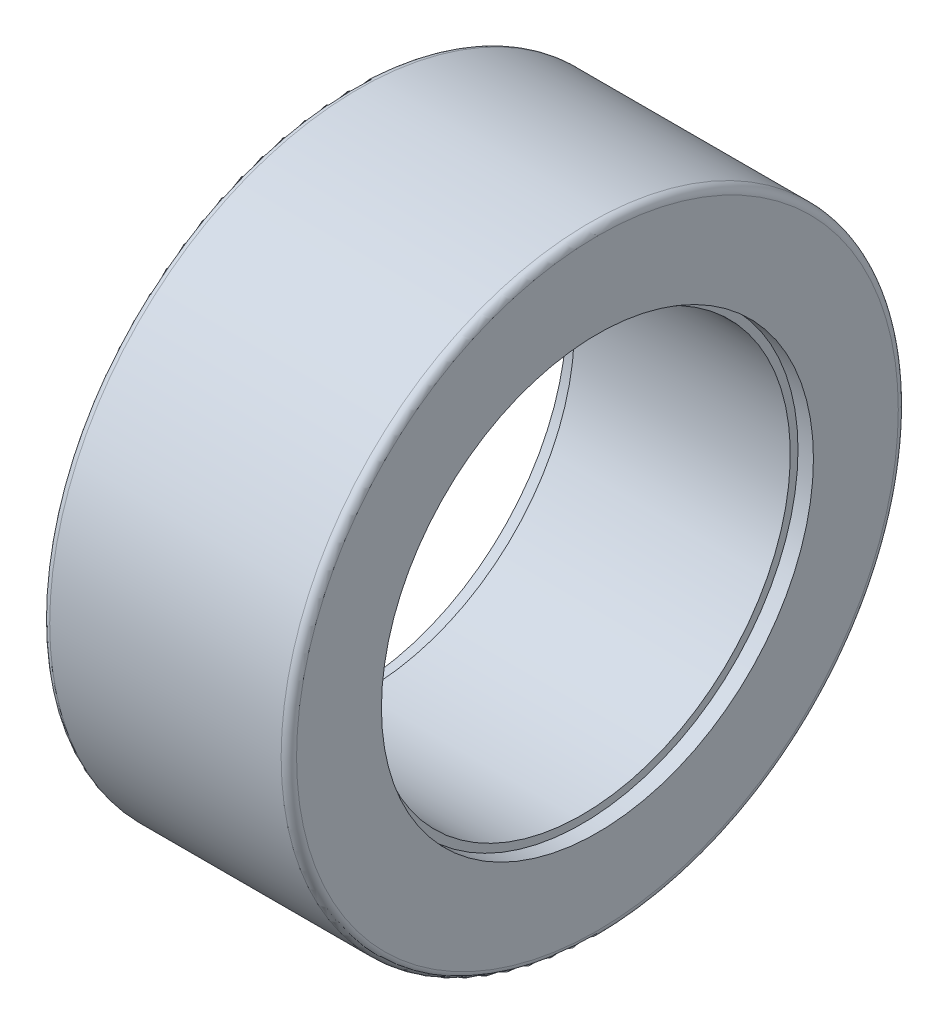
SolidWorks part; units mm, degrees
ref_plane "Front Plane" through (0, 0, 0) normal (0, 0, 1) x (1, 0, 0)
ref_plane "Top Plane" through (0, 0, 0) normal (0, 1, 0) x (1, 0, 0)
ref_plane "Right Plane" through (0, 0, 0) normal (1, 0, 0) x (0, 0, -1)
sketch "Sketch1" plane through (0, 0, 0) normal (0, 0, 1) x (1, 0, 0)
  line L0 (-79.5574, 0) -> (64.7749, 0) construction
  line L1 (0, -80.9027) -> (0, 74.2007) construction
  line L2 (-15, 40) -> (15, 40)
  line L3 (16, 39) -> (16, 28)
  line L4 (16, 28) -> (14, 28)
  line L5 (14, 28) -> (14, 27)
  line L6 (14, 27) -> (-14, 27)
  line L7 (-14, 27) -> (-14, 28)
  line L8 (-14, 28) -> (-16, 28)
  line L9 (-16, 28) -> (-16, 39)
  arc A0 (-15, 40) -> (-16, 39) centre (-15, 39) ccw
  arc A1 (15, 40) -> (16, 39) centre (15, 39) cw
  point P15 (-16, 40)
  dimension "D9" = 1
  dimension "D1" = 2
  dimension "D2" = 1
  dimension "D3" = 13
  dimension "D4" = 16
  dimension "D5" = 28
  dimension "D6" = 32
  dimension "D7" = 28
  dimension "D8" = 12
revolve "Revolve1" add sketch "Sketch1" angle 360 about L0
